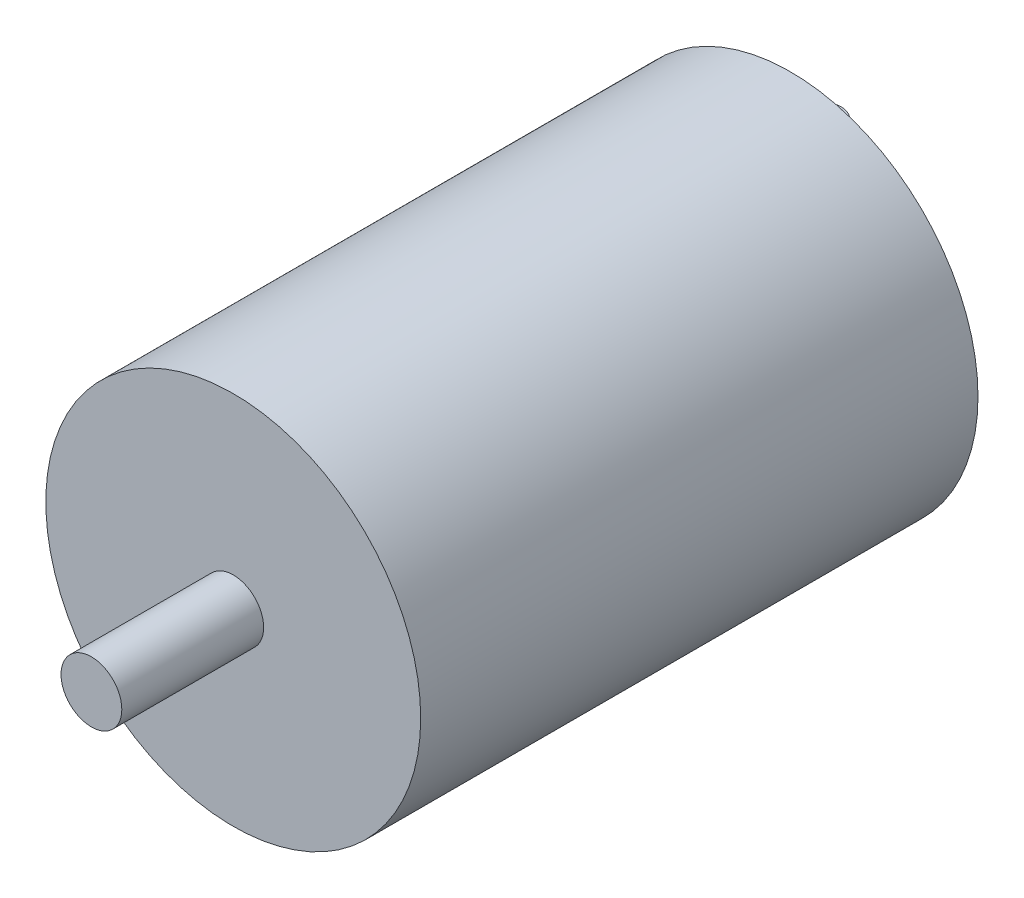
SolidWorks part; units mm, degrees
ref_plane "Front Plane" through (0, 0, 0) normal (0, 0, 1) x (1, 0, 0)
ref_plane "Top Plane" through (0, 0, 0) normal (0, 1, 0) x (1, 0, 0)
ref_plane "Right Plane" through (0, 0, 0) normal (1, 0, 0) x (0, 0, -1)
sketch "Sketch1" plane through (0, 0, 0) normal (0, 0, 1) x (1, 0, 0)
  circle A0 centre (0, 0) radius 18.5
  dimension "D1" = 37
extrude "Boss-Extrude1" add sketch "Sketch1" along normal blind 55
sketch "Sketch2" plane through (0, 0, 55) normal (0, 0, 1) x (1, 0, 0)
  circle A0 centre (0, 0) radius 3
  dimension "D1" = 6
extrude "Boss-Extrude2" add sketch "Sketch2" along normal blind 14
sketch "Sketch3" plane through (0, 0, 0) normal (0, 0, -1) x (-1, 0, 0)
  line L0 (0, 18.5) -> (0, -18.5) construction
  line L1 (-2, 13) -> (2, 13)
  line L2 (-2, 13) -> (-2, 12)
  line L3 (-2, 12) -> (2, 12)
  line L4 (2, 13) -> (2, 12)
  line L5 (-2, 13) -> (2, 12) construction
  line L6 (-2, 12) -> (2, 13) construction
  line L7 (-2, -12) -> (2, -12)
  line L8 (-2, -12) -> (-2, -13)
  line L9 (-2, -13) -> (2, -13)
  line L10 (2, -12) -> (2, -13)
  line L11 (-2, -12) -> (2, -13) construction
  line L12 (-2, -13) -> (2, -12) construction
  circle A0 centre (0, 0) radius 18.5 construction
  point P0 (0, 12.5)
  point P5 (0, -12.5)
  dimension "D1" = 12
  dimension "D2" = 12
  dimension "D3" = 4
  dimension "D4" = 0
  dimension "D5" = 4
  dimension "D6" = 0
  dimension "D7" = 1
  dimension "D8" = 1
extrude "Boss-Extrude3" add sketch "Sketch3" along normal blind 5
sketch "Sketch4" plane through (0, -13, 0) normal (0, -1, 0) x (1, 0, 0)
  line L0 (2, -5) -> (-2, -5) construction
  circle A0 centre (0, -3.2) radius 0.75
  dimension "D1" = 1.5
  dimension "D2" = 1.8
extrude "Cut-Extrude1" cut sketch "Sketch4" against normal blind 50
fillet "Fillet1" radius 2 4 edges at (2, -12.5, -5) (-2, -12.5, -5) (2, 12.5, -5) (-2, 12.5, -5)
